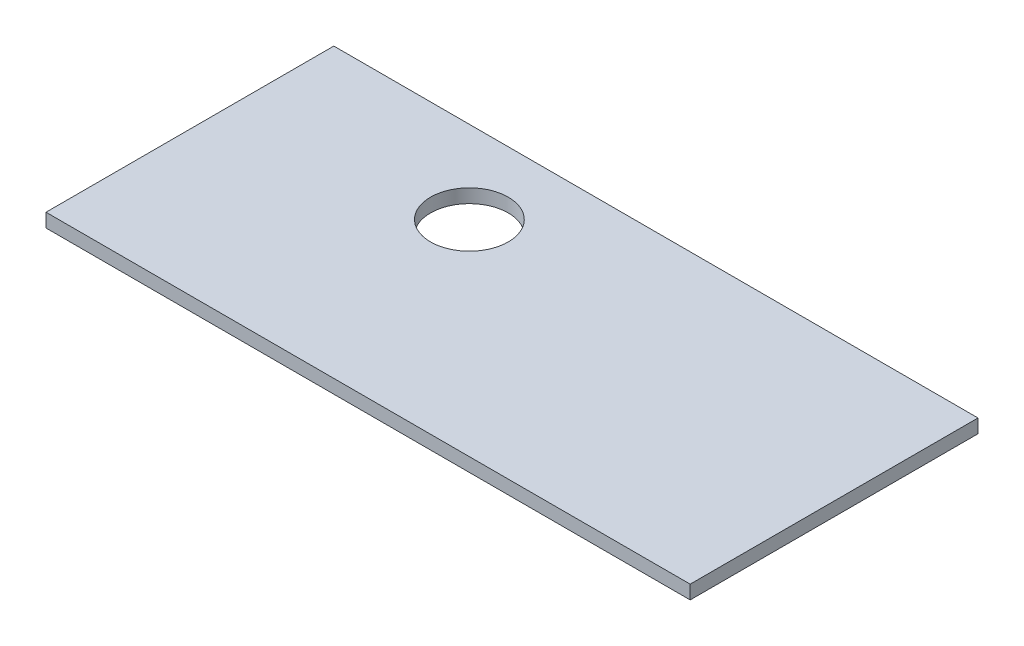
SolidWorks part; units mm, degrees
ref_plane "Front Plane" through (0, 0, 0) normal (0, 0, 1) x (1, 0, 0)
ref_plane "Top Plane" through (0, 0, 0) normal (0, 1, 0) x (1, 0, 0)
ref_plane "Right Plane" through (0, 0, 0) normal (1, 0, 0) x (0, 0, -1)
sketch "Sketch1" plane through (0, 0, 0) normal (0, 1, 0) x (1, 0, 0)
  line L1 (-70.5, -31.5) -> (70.5, -31.5)
  line L2 (-70.5, -31.5) -> (-70.5, 31.5)
  line L3 (-70.5, 31.5) -> (70.5, 31.5)
  line L4 (70.5, -31.5) -> (70.5, 31.5)
  line L5 (-70.5, -31.5) -> (70.5, 31.5) construction
  line L6 (-70.5, 31.5) -> (70.5, -31.5) construction
  point P0 (0, 0)
  dimension "D1" = 141
  dimension "D2" = 63
extrude "Boss-Extrude1" add sketch "Sketch1" along normal blind 3
sketch "Sketch2" plane through (0, 3, 0) normal (0, 1, 0) x (1, 0, 0)
  line L0 (70.5, 31.5) -> (-70.5, 31.5) construction
  line L1 (-70.5, 31.5) -> (-70.5, -31.5) construction
  circle A0 centre (-22.7794, 13.4534) radius 8.5
  dimension "D1" = 17
  dimension "D2" = 18.0466
  dimension "D3" = 47.7206
extrude "Cut-Extrude1" cut sketch "Sketch2" against normal up to next
